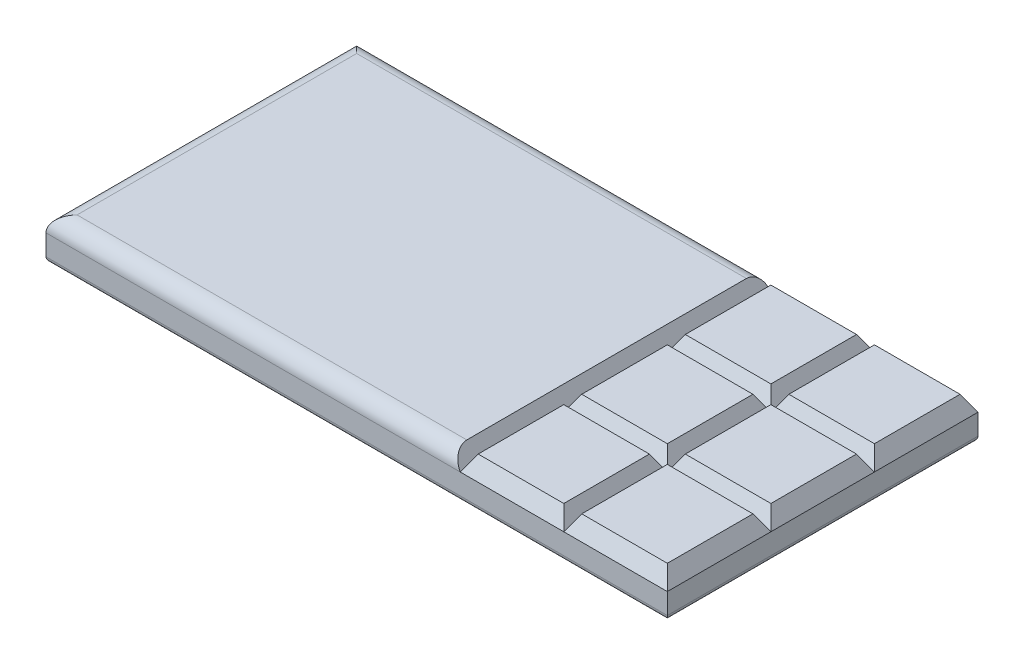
SolidWorks part; units mm, degrees
ref_plane "Front Plane" through (0, 0, 0) normal (0, 0, 1) x (1, 0, 0)
ref_plane "Top Plane" through (0, 0, 0) normal (0, 1, 0) x (1, 0, 0)
ref_plane "Right Plane" through (0, 0, 0) normal (1, 0, 0) x (0, 0, -1)
sketch "Sketch1" plane through (0, 0, 0) normal (0, 1, 0) x (1, 0, 0)
  line L1 (-60, -30) -> (60, -30)
  line L2 (-60, -30) -> (-60, 30)
  line L3 (-60, 30) -> (60, 30)
  line L4 (60, -30) -> (60, 30)
  line L5 (-60, -30) -> (60, 30) construction
  line L6 (-60, 30) -> (60, -30) construction
  point P0 (0, 0)
  dimension "D1" = 60
  dimension "D2" = 120
extrude "Boss-Extrude1" add sketch "Sketch1" along normal blind 8
sketch "Sketch2" plane through (0, 0, 30) normal (0, 0, 1) x (1, 0, 0)
  line L0 (-60, 8) -> (60, 8) construction
  line L1 (40, 5) -> (42.5981, 9.5)
  line L2 (42.5981, 9.5) -> (37.4019, 9.5)
  line L3 (37.4019, 9.5) -> (40, 5)
  line L4 (20, 5) -> (22.5981, 9.5)
  line L5 (22.5981, 9.5) -> (17.4019, 9.5)
  line L6 (17.4019, 9.5) -> (20, 5)
  line L7 (60, 5) -> (62.5981, 9.5)
  line L8 (62.5981, 9.5) -> (57.4019, 9.5)
  line L9 (57.4019, 9.5) -> (60, 5)
  circle A0 centre (40, 8) radius 1.5 construction
  circle A1 centre (20, 8) radius 1.5 construction
  circle A2 centre (60, 8) radius 1.5 construction
  dimension "D1" = 3
  dimension "D2" = 20
  dimension "D4" = 20
  dimension "D3" = 2
  dimension "D5" = 2
extrude "Cut-Extrude1" cut sketch "Sketch2" against normal through all
sketch "Sketch3" plane through (60, 0, 0) normal (1, 0, 0) x (0, 0, -1)
  line L0 (-10, 5) -> (-7.4019, 9.5)
  line L1 (-7.4019, 9.5) -> (-12.5981, 9.5)
  line L2 (-12.5981, 9.5) -> (-10, 5)
  line L3 (10, 5) -> (12.5981, 9.5)
  line L4 (12.5981, 9.5) -> (7.4019, 9.5)
  line L5 (7.4019, 9.5) -> (10, 5)
  line L6 (-30, 8) -> (30, 8) construction
  line L10 (30, 5) -> (32.5981, 9.5)
  line L11 (32.5981, 9.5) -> (27.4019, 9.5)
  line L12 (27.4019, 9.5) -> (30, 5)
  line L13 (-30, 5) -> (-30, 0) construction
  line L14 (-30, 5) -> (-27.4019, 9.5)
  line L15 (-27.4019, 9.5) -> (-32.5981, 9.5)
  line L16 (-32.5981, 9.5) -> (-30, 5)
  circle A0 centre (-10, 8) radius 1.5 construction
  circle A1 centre (10, 8) radius 1.5 construction
  circle A2 centre (30, 8) radius 1.5 construction
  circle A3 centre (-30, 8) radius 1.5 construction
  dimension "D1" = 3
  dimension "D2" = 20
  dimension "D4" = 20
  dimension "D6" = 20
  dimension "D3" = 3
  dimension "D5" = 2
extrude "Cut-Extrude2" cut sketch "Sketch3" against normal up to surface (42.5981 mm away)
fillet "Fillet1" radius 1 4 edges at (0, 0, -30) (-60, 0, 0) (0, 0, 30) (60, 0, 0)
fillet "Fillet2" radius 3 3 edges at (-20.866, 8, -30) (-60, 8, 0) (-20.866, 8, 30)
